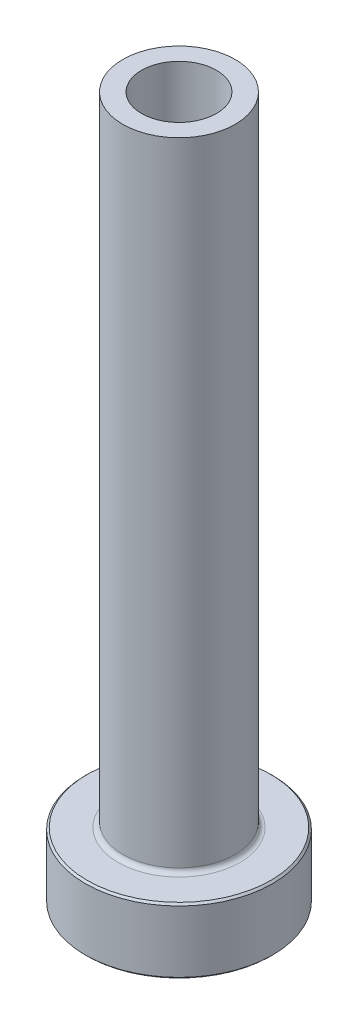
SolidWorks part; units mm, degrees
ref_plane "Front Plane" through (0, 0, 0) normal (0, 0, 1) x (1, 0, 0)
ref_plane "Top Plane" through (0, 0, 0) normal (0, 1, 0) x (1, 0, 0)
ref_plane "Right Plane" through (0, 0, 0) normal (1, 0, 0) x (0, 0, -1)
sketch "Sketch1" plane through (0, 0, 0) normal (0, 0, 1) x (1, 0, 0)
  line L0 (-4, 75) -> (-6, 75)
  line L1 (-6, 75) -> (-6, 7)
  line L2 (-6, 7) -> (-10, 7)
  line L3 (-10, 7) -> (-10, 0)
  line L4 (11, 0) -> (-11, 0) construction
  line L5 (-10, 0) -> (-4.25, 0)
  line L6 (-4, 30) -> (-4, 75)
  line L7 (0, 92.1877) -> (0, -15.5353) construction
  line L8 (0, -11) -> (0, 11) construction
  line L9 (-4, 30) -> (-4.25, 18)
  line L10 (-4.25, 18) -> (-4.25, 0)
  dimension "D1" = 0.25
  dimension "ID" = 8
  dimension "OD" = 12
  dimension "L" = 75
  dimension "H" = 20
  dimension "T" = 7
  dimension "N" = 45
  dimension "D2" = 12
revolve "Revolve1" add sketch "Sketch1" angle 360 about L7
fillet "Fillet1" radius 0.5 1 edges at (0, 7, 6)
chamfer "Chamfer1" distance 0.2 angle 45 2 edges at (0, 7, 10) (0, 0, 10)
chamfer "Chamfer3" distance 0.5 angle 45 1 edges at (0, 0, 4.25)
